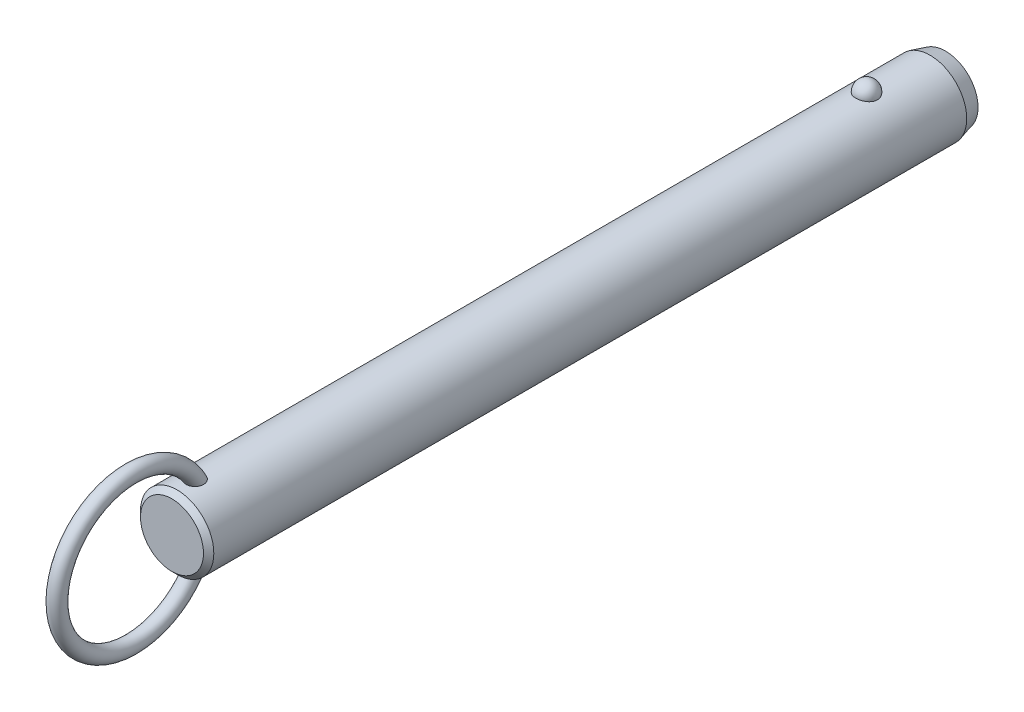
SolidWorks part; units mm, degrees
ref_plane "Front Plane" through (0, 0, 0) normal (0, 0, 1) x (1, 0, 0)
ref_plane "Top Plane" through (0, 0, 0) normal (0, 1, 0) x (1, 0, 0)
ref_plane "Right Plane" through (0, 0, 0) normal (1, 0, 0) x (0, 0, -1)
sketch "Sketch2" plane through (0, 0, 0) normal (0, 0, 1) x (1, 0, 0)
  circle A0 centre (0, 0) radius 7.1
  point P3 (0, 7.1)
  dimension "D1" = 14.2
extrude "Boss-Extrude1" add sketch "Sketch2" along normal blind 124.5
sketch "Sketch3" plane through (0, 0, 0) normal (0, 0, -1) x (-1, 0, 0)
  circle A0 centre (0, 0) radius 7.1
  dimension "D1" = 14.2
extrude "Boss-Extrude2" add sketch "Sketch3" along normal blind 17.4
chamfer "Chamfer1" distance 3 angle 15 1 edges at (-7.1, 0, -17.4)
sketch "Sketch12" plane through (0, 0, 0) normal (1, 0, 0) x (0, 0, -1)
  line L0 (-124.5, 7.1) -> (-124.5, -7.1) construction
  point P0 (-124.5, 0)
sketch "Sketch13" plane through (0, 0, 0) normal (1, 0, 0) x (0, 0, -1)
  circle A0 centre (-140.35, 0) radius 15.85
  point P2 (-124.5, 0)
  dimension "D1" = 31.7
sketch "Sketch14" plane through (0, 0, 0) normal (0, 1, 0) x (1, 0, 0)
  circle A0 centre (0, -126) radius 1.5
  point P2 (0, -124.5)
  dimension "D1" = 3
sweep "Sweep1" add profiles "Sketch14" path "Sketch13"
sketch "Sketch15" plane through (0, 0, 124.5) normal (0, 0, 1) x (1, 0, 0)
  circle A0 centre (0, 0) radius 7.1
  dimension "D1" = 14.2
extrude "Boss-Extrude3" add sketch "Sketch15" along normal blind 7.92
chamfer "Chamfer2" distance 1 angle 45 1 edges at (7.1, 0, 132.42)
sketch "Sketch18" plane through (0, 0, 0) normal (1, 0, 0) x (0, 0, -1)
  line L0 (14.4, 7.1) -> (-126.1792, 7.1) construction
  line L1 (2.1, 9.2) -> (2.1, 5)
  line L2 (-126.1792, -7.1) -> (14.4, -7.1) construction
  arc A0 (2.1, 9.2) -> (2.1, 5) centre (2.1, 7.1) ccw
  point P4 (0, 7.1)
  dimension "D1" = 16.3
revolve "Revolve1" add sketch "Sketch18" angle 360 about L1
